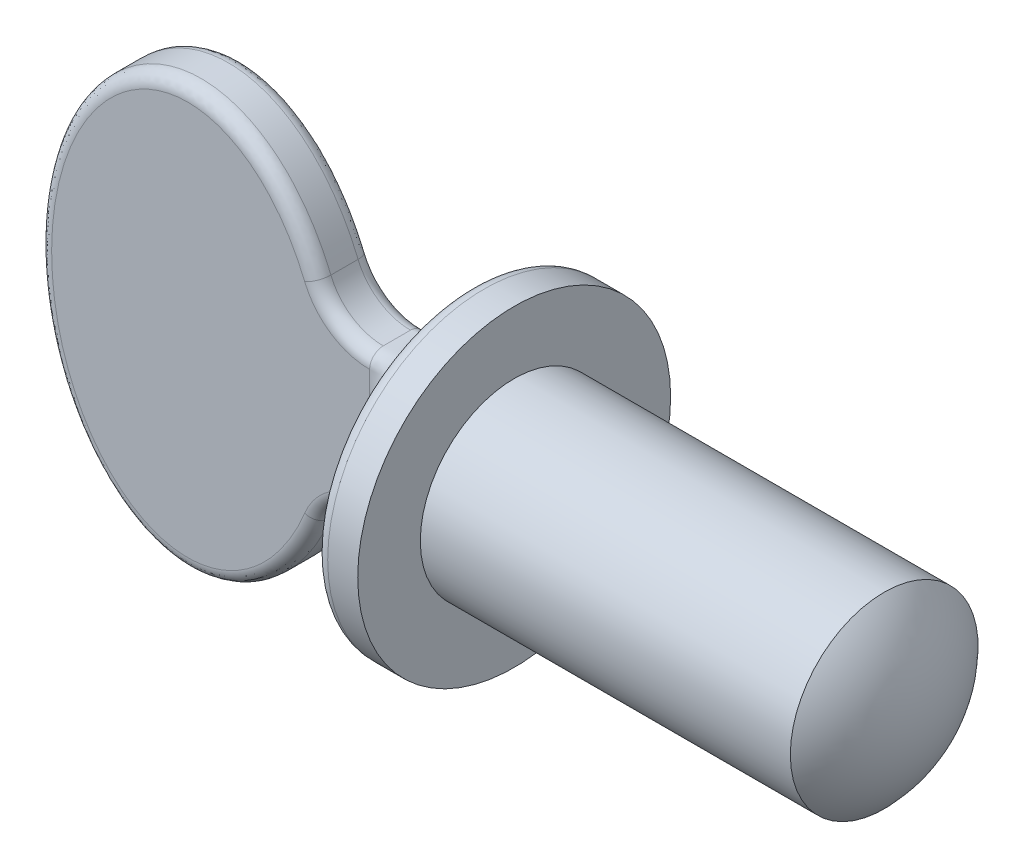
SolidWorks part; units mm, degrees
ref_plane "Front Plane" through (0, 0, 0) normal (0, 0, 1) x (1, 0, 0)
ref_plane "Top Plane" through (0, 0, 0) normal (0, 1, 0) x (1, 0, 0)
ref_plane "Right Plane" through (0, 0, 0) normal (1, 0, 0) x (0, 0, -1)
sketch "layout" plane through (0, 0, 0) normal (0, 0, 1) x (1, 0, 0)
  line L0 (0, 0) -> (13.208, 0) construction
  line L1 (5.588, 2.921) -> (5.588, -2.921)
  line L2 (3.3976, 1.3123) -> (4.8921, 1.3123) construction
  line L3 (5.588, 2.921) -> (4.7897, 2.921)
  line L4 (4.7897, 2.921) -> (4.7897, 3.2655) construction
  line L5 (4.2865, 1.706) -> (4.2865, 0)
  line L6 (4.2865, 1.706) -> (3.3355, 0.7551) construction
  line L7 (13.208, 1.7526) -> (13.208, 0)
  line L8 (3.3976, 1.3123) -> (3.3976, -1.3123)
  line L9 (13.208, 1.7526) -> (5.588, 1.7526)
  arc A0 (3.3976, 1.3123) -> (2.4197, 1.9685) centre (3.3976, 2.3692) cw
  arc A1 (4.7897, 2.921) -> (4.2865, 1.706) centre (3.0715, 2.921) cw
  arc A2 (3.3976, -1.3123) -> (2.4197, -1.9685) centre (3.3976, -2.3692) ccw
  ellipse E0 centre (0, 0) end of major axis (0, 3.937) minor radius 2.794 (2.4197, 1.9685) -> (2.4197, -1.9685) ccw
sketch "Sketch3" plane through (0, 0, 0) normal (0, 0, 1) x (1, 0, 0)
  line L0 (3.3976, 1.3123) -> (3.3976, -1.3123) construction
  line L1 (3.3976, 1.3123) -> (3.3976, -1.3123)
  arc A0 (3.3976, -1.3123) -> (2.4197, -1.9685) centre (3.3976, -2.3692) ccw construction
  arc A1 (2.4197, 1.9685) -> (3.3976, 1.3123) centre (3.3976, 2.3692) ccw construction
  arc A2 (3.3976, -1.3123) -> (2.4197, -1.9685) centre (3.3976, -2.3692) ccw
  arc A3 (2.4197, 1.9685) -> (3.3976, 1.3123) centre (3.3976, 2.3692) ccw
  ellipse E0 centre (0, 0) end of major axis (0, 3.937) minor radius 2.794 (2.4197, 1.9685) -> (2.4197, -1.9685) ccw construction
  ellipse E1 centre (0, 0) end of major axis (0, 3.937) minor radius 2.794 (2.4197, 1.9685) -> (2.4197, -1.9685) ccw
extrude "Extrude1" add sketch "Sketch3" along normal mid plane 1.016
fillet "Fillet1" radius 0.254 6 edges at (2.8088, 1.4916, -0.508) (2.8088, -1.4916, -0.508) (2.8088, 1.4916, 0.508) (2.8088, -1.4916, 0.508) (-2.794, 0, -0.508) (-2.794, 0, 0.508)
sketch "Sketch4" plane through (0, 0, 0) normal (0, 0, 1) x (1, 0, 0)
  line L1 (13.208, 1.7526) -> (5.588, 1.7526) construction
  line L2 (5.588, 2.921) -> (5.588, -2.921) construction
  line L3 (5.588, 2.921) -> (4.7897, 2.921) construction
  line L4 (4.2865, 1.706) -> (4.2865, 0) construction
  line L5 (13.208, 1.7526) -> (13.208, 0) construction
  line L6 (12.4966, 1.7526) -> (5.588, 1.7526)
  line L7 (5.588, 2.921) -> (5.588, 1.7526)
  line L8 (5.588, 2.921) -> (4.7897, 2.921)
  line L9 (4.2865, 1.706) -> (4.2865, 0)
  line L10 (0, 0) -> (16.8942, 0) construction
  line L11 (13.208, 0) -> (4.2865, 0)
  line L12 (13.208, 1.7526) -> (13.208, 0) construction
  arc A0 (4.2865, 1.706) -> (4.7897, 2.921) centre (3.0715, 2.921) ccw construction
  arc A1 (4.2865, 1.706) -> (4.7897, 2.921) centre (3.0715, 2.921) ccw
  arc A2 (13.208, 0) -> (12.4966, 1.7526) centre (10.6934, 0) ccw
revolve "Revolve1" add sketch "Sketch4" angle 360 about L10
loft "Loft1" add
fillet "Fillet2" radius 0.254 1 edges at (4.7897, 0, 2.921)
sketch "Sketch5" plane through (0, 0, 0) normal (0, 1, 0) x (1, 0, 0)
  line L0 (11.9511, 2.2981) -> (12.4966, 2.2981)
  line L1 (12.4966, 2.2981) -> (12.4966, 1.7526)
  line L2 (12.4966, 1.7526) -> (12.2239, 1.2802)
  line L3 (12.2239, 1.2802) -> (11.9511, 1.7526)
  line L5 (11.9511, 1.7526) -> (11.9511, 2.2981)
  line L7 (-3.6147, 0) -> (14.1406, 0) construction
revolve "Cut-Revolve10" [suppressed] cut sketch "Sketch5" angle 360 about L7
pattern_linear "LPattern10" [suppressed] count 8 along (1, 0, 0)
equation "\"D4@layout\" = \"Head Height@layout\" / 3 * 2"
equation "\"D5@layout\" = \"Head Width@layout\" / 3"
equation "\"D6@layout\" = \"Head Width@layout\" / 2"
equation "\"D7@layout\" = \"D5@layout\" * 1.3"
equation "\"D8@layout\" = \"D4@layout\"  / 7"
equation "\"D1@Fillet1\" = \"Head Thickness@Extrude1\" / 4"
equation "\"D1@Fillet2\" = \"D1@Fillet1\""
equation "\"D1@Sketch5\" = ( \"Base Screw Dia@layout\"- \"Minor Dia@Cosmetic Thread1\" )  / 2"
equation "\"D1@LPattern10\" = int((\"Length@layout\"-\"Ref@Sketch4\")/\"Advance@LPattern10\")"
